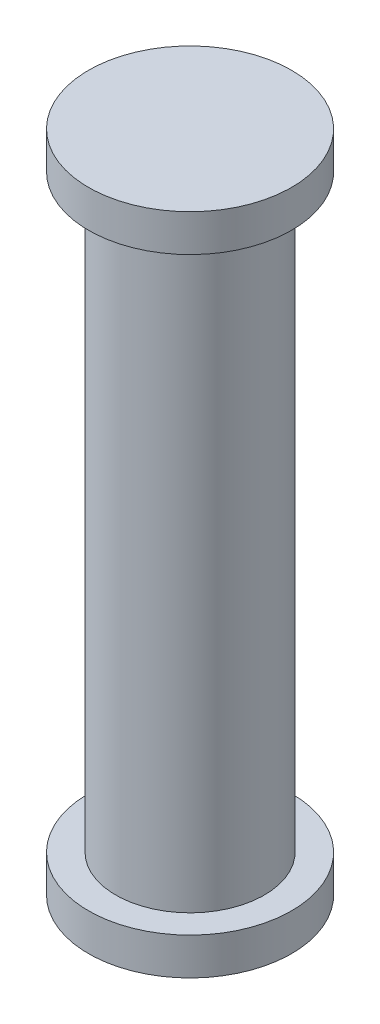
SolidWorks part; units mm, degrees
ref_plane "Front" through (0, 0, 0) normal (0, 0, 1) x (1, 0, 0)
ref_plane "Top" through (0, 0, 0) normal (0, 1, 0) x (1, 0, 0)
ref_plane "Right" through (0, 0, 0) normal (1, 0, 0) x (0, 0, -1)
sketch "Sketch1" plane through (0, 0, 0) normal (1, 0, 0) x (0, 0, -1)
  line L0 (0, 0) -> (4.1, 0)
  line L1 (4.1, 0) -> (4.1, -1.5)
  line L2 (4.1, -1.5) -> (3, -1.5)
  line L3 (3, -1.5) -> (3, -25.3)
  line L4 (3, -25.3) -> (4.1, -25.3)
  line L5 (4.1, -25.3) -> (4.1, -26.8)
  line L6 (4.1, -26.8) -> (0, -26.8)
  line L7 (0, -26.8) -> (0, 0)
  dimension "D1" = 26.8
  dimension "D2" = 1.5
  dimension "D3" = 1.5
  dimension "D4" = 4.1
  dimension "D5" = 4.1
  dimension "D6" = 1.1
revolve "Revolve1" add sketch "Sketch1" angle 360 about L7
